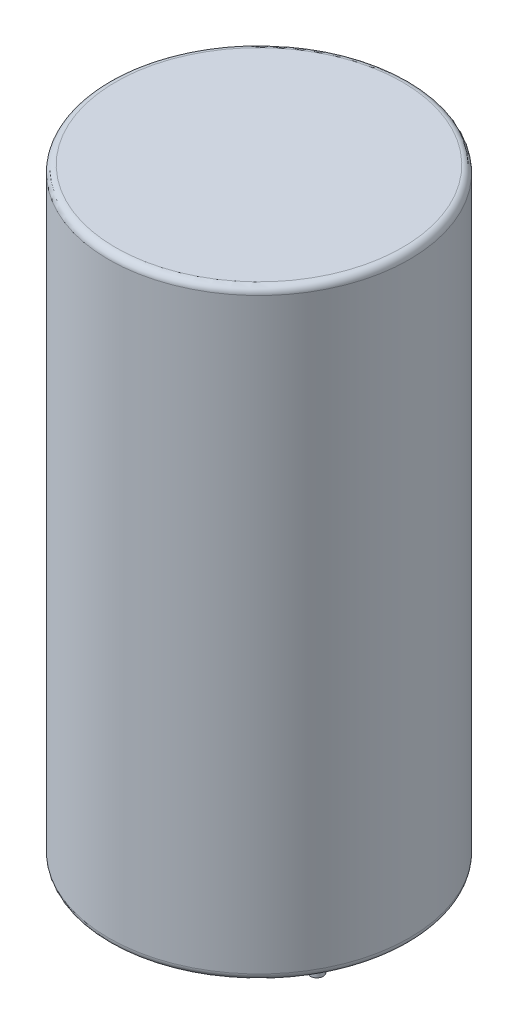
SolidWorks part; units mm, degrees
ref_plane "Front Plane" through (0, 0, 0) normal (0, 0, 1) x (1, 0, 0)
ref_plane "Top Plane" through (0, 0, 0) normal (0, 1, 0) x (1, 0, 0)
ref_plane "Right Plane" through (0, 0, 0) normal (1, 0, 0) x (0, 0, -1)
sketch "Sketch1" plane through (0, 0, 0) normal (0, 1, 0) x (1, 0, 0)
  circle A0 centre (0, 0) radius 6.5
  dimension "D1" = 13
extrude "Boss-Extrude1" add sketch "Sketch1" along normal blind 26
fillet "Fillet1" radius 0.3 2 edges at (0, 0, 6.5) (0, 26, 6.5)
sketch "Sketch2" plane through (0, 0, 0) normal (0, -1, 0) x (1, 0, 0)
  line L0 (0, 0) -> (0, 2.3521) construction
  circle A0 centre (-2.5, 0) radius 0.275
  circle A1 centre (2.5, 0) radius 0.275
  dimension "D2" = 0.55
  dimension "D1" = 5
extrude "Boss-Extrude2" add sketch "Sketch2" along normal blind 3
